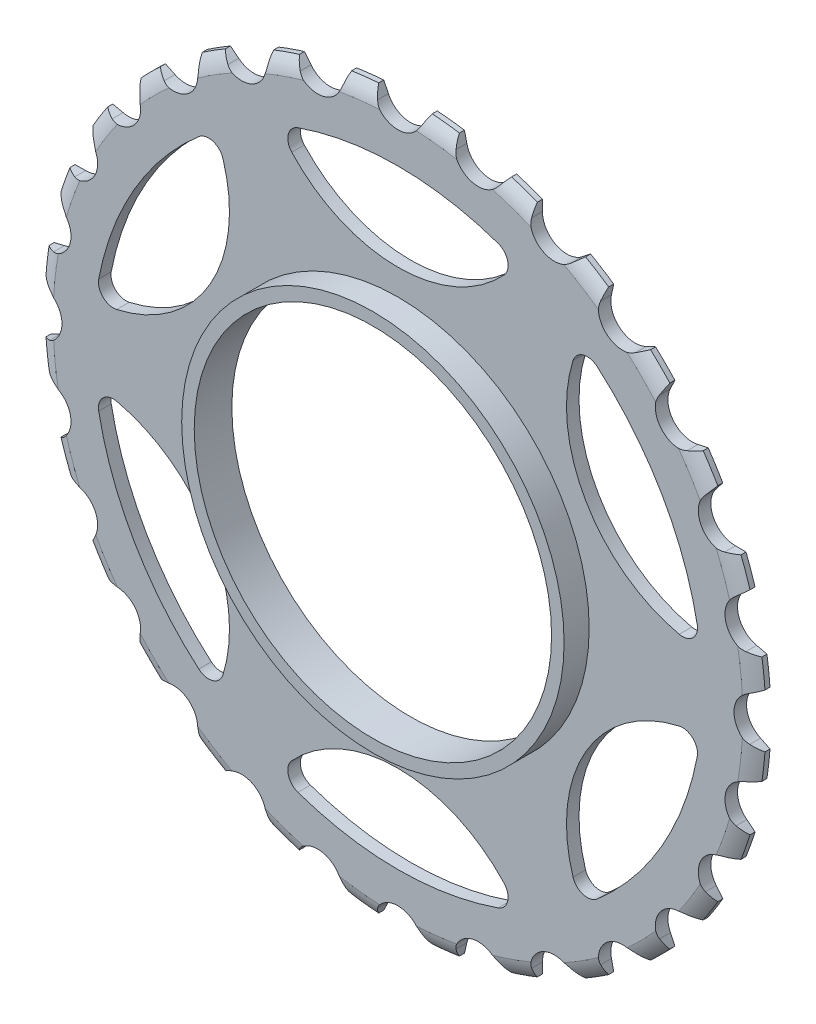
SolidWorks part; units mm, degrees
ref_plane "Front" through (0, 0, 0) normal (0, 0, 1) x (1, 0, 0)
ref_plane "Top" through (0, 0, 0) normal (0, 1, 0) x (1, 0, 0)
ref_plane "Right" through (0, 0, 0) normal (1, 0, 0) x (0, 0, -1)
sketch "Sketch1" plane through (0, 0, 0) normal (0, 0, 1) x (1, 0, 0)
  line L0 (0, 53.6) -> (0, 0) construction
  line L1 (0, 53.6) -> (0, 57.5) construction
  line L2 (0, 57.5) -> (0, 60.35) construction
  circle A0 centre (0, 0) radius 53.6 construction
  circle A3 centre (0, 0) radius 57.5 construction
  arc A4 (-5.7825, 60.0723) -> (-3.5254, 55.8323) centre (-49.4464, 34.1089) cw
  arc A5 (5.7825, 60.0723) -> (3.5254, 55.8323) centre (49.4464, 34.1089) ccw
  arc A6 (-3.5254, 55.8323) -> (3.5254, 55.8323) centre (0, 57.5) ccw
  arc A10 (5.7825, 60.0723) -> (-5.7825, 60.0723) centre (0, 0) ccw
  point P4 (6.3403, 57.1494)
  dimension "D1" = 2.85
  dimension "D2" = 3.9
  dimension "D3" = 50.8
  dimension "D5" = 11.5649
  dimension "D6" = 115
  dimension "D4" = 6.35
sketch "Sketch2" plane through (0, 0, 0) normal (1, 0, 0) x (0, 0, -1)
  line L0 (-1.2, 28.5) -> (0.8, 28.5)
  line L1 (0, 57.5) -> (0, -57.5) construction
  line L5 (-1.2, 28.5) -> (-1.2, 55)
  line L7 (0, 57.5) -> (0.8, 57.5)
  line L8 (0.8, 28.5) -> (0.8, 57.5)
  arc A0 (-1.2, 55) -> (0, 57.5) centre (4.1982, 53.9469) cw
  dimension "D4" = 2
  dimension "D7" = 5.5
  dimension "D1" = 28.5
  dimension "D5" = 2.5
  dimension "D6" = 0.8
ref_axis "Axis1" through (0, 0, -80.9) along (0, 0, 1)
revolve "Revolve1" add sketch "Sketch2" angle 360 about axis through (0, 0, -80.9) along (0, 0, 1)
extrude "Extrude1" cut sketch "Sketch1" against normal through all and the other way through all
sketch "Sketch3" plane through (0, 0, 0) normal (0, 0, 1) x (1, 0, 0)
  line L0 (0, 48.6) -> (0, 34.6) construction
  line L1 (-17.5, 44.2253) -> (17.5, 44.2253) construction
  line L2 (0, 53.6) -> (0, 48.6) construction
  arc A0 (-16.9386, 42.0227) -> (16.9386, 42.0227) centre (0, 57.6383) ccw
  arc A1 (-15.9659, 45.9026) -> (15.9659, 45.9026) centre (0, 0) cw
  arc A2 (-16.9386, 42.0227) -> (-15.9659, 45.9026) centre (-15.1802, 43.6438) cw
  arc A3 (15.9659, 45.9026) -> (16.9386, 42.0227) centre (15.1802, 43.6438) cw
  arc A4 (-2.9265, 54.9221) -> (2.9265, 54.9221) centre (0, 57.5) ccw construction
  arc A5 (0, 53.6) -> (-14.9357, 51.477) centre (0, 0) ccw construction
  point P13 (0, 53.6)
  dimension "D1" = 14
  dimension "D2" = 5
  dimension "D3" = 4
  dimension "D4" = 35
extrude "Extrude2" cut sketch "Sketch3" against normal through all and the other way through all
pattern_circular "CirPattern1" count 28 over 360 about axis through (0, 0, 0) along (0, 0, 1) of "Extrude1"
pattern_circular "CirPattern2" count 6 over 360 about axis through (0, 0, 0) along (0, 0, 1) of "Extrude2"
sketch "Sketch4" plane through (0, 0, 1.2) normal (0, 0, 1) x (1, 0, 0)
  circle A0 centre (0, 0) radius 28.5 construction
  circle A1 centre (0, 0) radius 28.5
extrude "Extrude-Thin1" add sketch "Sketch4" along normal blind 4 thin
